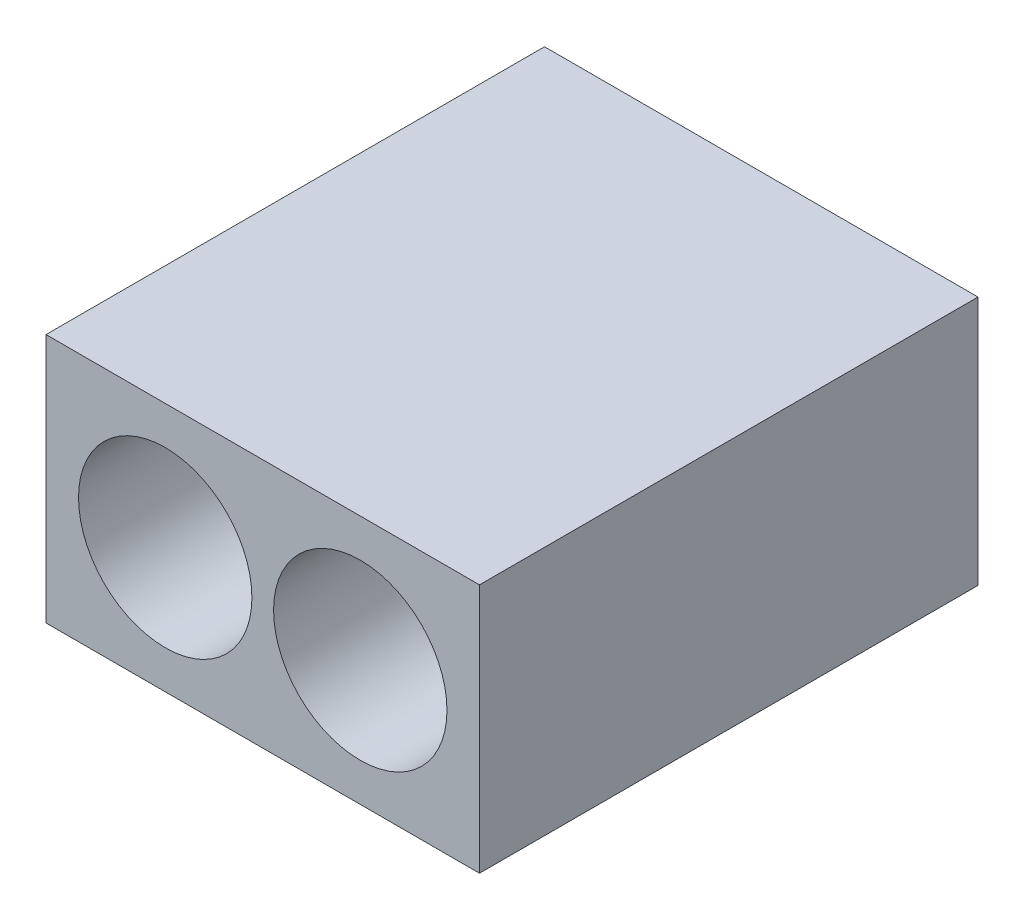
SolidWorks part; units mm, degrees
ref_plane "Front Plane" through (0, 0, 0) normal (0, 0, 1) x (1, 0, 0)
ref_plane "Top Plane" through (0, 0, 0) normal (0, 1, 0) x (1, 0, 0)
ref_plane "Right Plane" through (0, 0, 0) normal (1, 0, 0) x (0, 0, -1)
sketch "Sketch1" plane through (0, 0, 0) normal (0, 0, 1) x (1, 0, 0)
  line L1 (-10, -5.762) -> (10, -5.762)
  line L2 (-10, -5.762) -> (-10, 5.762)
  line L3 (-10, 5.762) -> (10, 5.762)
  line L4 (10, -5.762) -> (10, 5.762)
  line L5 (-10, -5.762) -> (10, 5.762) construction
  line L6 (-10, 5.762) -> (10, -5.762) construction
  point P0 (0, 0)
  dimension "D1" = 11.524
  dimension "D2" = 20
extrude "Boss-Extrude1" add sketch "Sketch1" along normal blind 23
hole_wizard "CBORE for M4 SHCS1" positions "Sketch3" profile "Sketch2" counterbore size "M4" standard "ANSI Metric"
sketch "Sketch3" plane through (0, 0, 23) normal (0, 0, 1) x (1, 0, 0)
  line L0 (0, 0) -> (-4.5, 0) construction
  line L2 (0, 0) -> (0, 5.762) construction
  line L3 (10, 5.762) -> (-10, 5.762) construction
  point P0 (-4.5, 0)
  point P14 (4.5, 0)
  dimension "D1" = 9
sketch "Sketch2" plane through (-4.5, 0, 23) normal (1, 0, 0) x (0, -1, 0)
  line L0 (0, 0) -> (0, 23)
  line L1 (0, 23) -> (2.25, 23)
  line L3 (2.25, 23) -> (2.25, 9)
  line L4 (2.25, 9) -> (4, 9)
  line L5 (4, 9) -> (4, 0)
  line L7 (4, 0) -> (0, 0)
  line L11 (0, -6.35) -> (0, 107.95) construction
  dimension "Thru Hole Dia." = 4.5
  dimension "Thru Hole Depth" = 23
  dimension "C'Bore Dia." = 8
  dimension "C'Bore Depth" = 9
